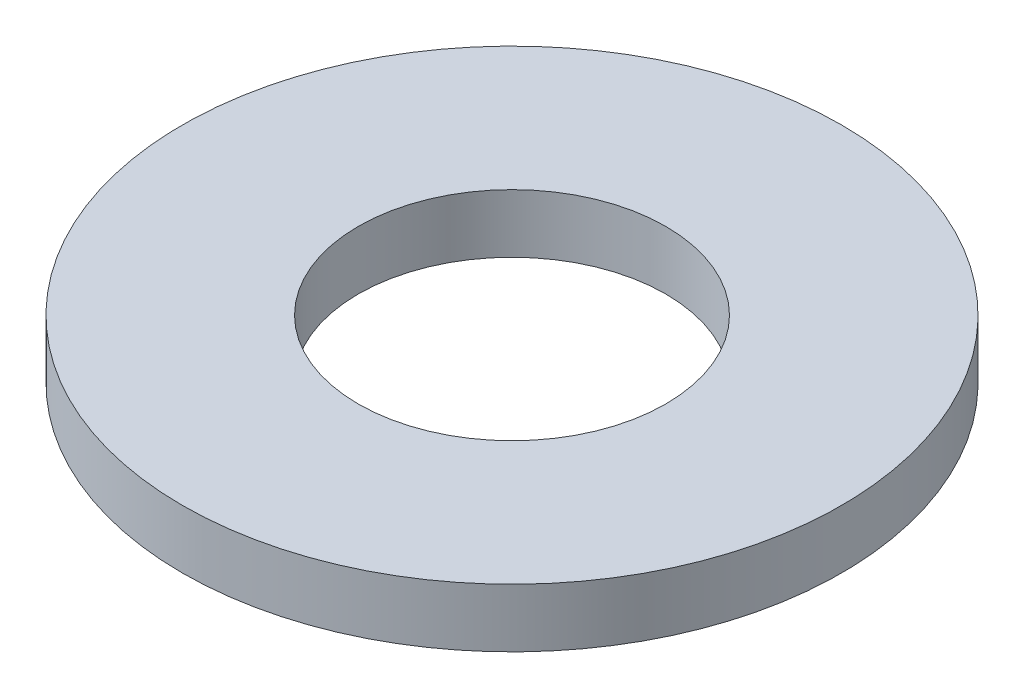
SolidWorks part; units mm, degrees
ref_plane "Front Plane" through (0, 0, 0) normal (0, 0, 1) x (1, 0, 0)
ref_plane "Top Plane" through (0, 0, 0) normal (0, 1, 0) x (1, 0, 0)
ref_plane "Right Plane" through (0, 0, 0) normal (1, 0, 0) x (0, 0, -1)
sketch "Sketch1" plane through (0, 0, 0) normal (0, 1, 0) x (1, 0, 0)
  circle A0 centre (0, 0) radius 2.1
  circle A1 centre (0, 0) radius 4.5
  dimension "D1" = 4.2
  dimension "D2" = 9
extrude "Boss-Extrude1" add sketch "Sketch1" along normal blind 0.8
